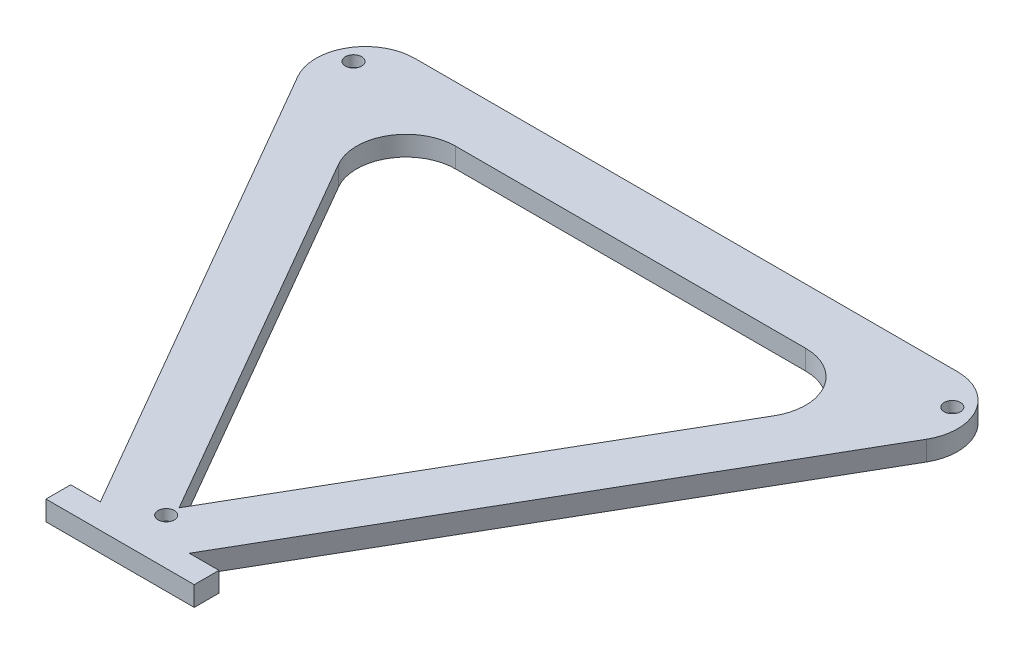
SolidWorks part; units mm, degrees
ref_plane "Front Plane" through (0, 0, 0) normal (0, 0, 1) x (1, 0, 0)
ref_plane "Top Plane" through (0, 0, 0) normal (0, 1, 0) x (1, 0, 0)
ref_plane "Right Plane" through (0, 0, 0) normal (1, 0, 0) x (0, 0, -1)
sketch "Sketch1" plane through (0, 0, 0) normal (0, 1, 0) x (1, 0, 0)
  line L0 (-50.5522, -73.9966) -> (-105.142, 20.5556)
  line L1 (-50.5522, -73.9966) -> (-56.5522, -73.9966)
  line L2 (-56.5522, -78.9966) -> (-56.5522, -73.9966)
  line L3 (-36.5522, -78.9966) -> (-46.5522, -78.9966)
  line L4 (-46.5522, -78.9966) -> (-56.5522, -78.9966)
  line L5 (-26.5522, -78.9966) -> (-36.5522, -78.9966)
  line L6 (-26.5522, -78.9966) -> (-26.5522, -73.9966)
  line L7 (-26.5522, -73.9966) -> (-32.5522, -73.9966)
  line L8 (22.0375, 20.5556) -> (-32.5522, -73.9966)
  line L9 (-96.4817, 35.5556) -> (13.3773, 35.5556)
  line L19 (2.5375, 9.2973) -> (-41.5522, -67.0684)
  line L20 (-76.9817, 24.2973) -> (-6.1227, 24.2973)
  line L21 (-41.5522, -67.0684) -> (-85.642, 9.2973)
  circle A0 centre (-41.5522, -69.6665) radius 1.5
  circle A1 centre (19.0375, 28.8236) radius 1.5775
  circle A2 centre (-102.142, 28.8236) radius 1.5
  arc A3 (-96.4817, 35.5556) -> (-105.142, 30.5556) centre (-96.4817, 25.5556) ccw
  arc A4 (-105.142, 30.5556) -> (-105.142, 20.5556) centre (-96.4817, 25.5556) ccw
  arc A5 (22.0375, 20.5556) -> (22.0375, 30.5556) centre (13.3773, 25.5556) ccw
  arc A6 (22.0375, 30.5556) -> (13.3773, 35.5556) centre (13.3773, 25.5556) ccw
  arc A11 (2.5375, 9.2973) -> (2.5375, 19.2973) centre (-6.1227, 14.2973) ccw
  arc A12 (2.5375, 19.2973) -> (-6.1227, 24.2973) centre (-6.1227, 14.2973) ccw
  arc A13 (-76.9817, 24.2973) -> (-85.642, 19.2973) centre (-76.9817, 14.2973) ccw
  arc A14 (-85.642, 19.2973) -> (-85.642, 9.2973) centre (-76.9817, 14.2973) ccw
  dimension "D1" = 3
  dimension "D2" = 3.155
  dimension "D3" = 10
  dimension "D4" = 13.3773
  dimension "D5" = 19.0375
  dimension "D6" = 22.0375
  dimension "D7" = 26.5522
  dimension "D8" = 32.5522
  dimension "D9" = 36.5522
  dimension "D10" = 41.5522
  dimension "D11" = 20.5556
  dimension "D13" = 28.8236
  dimension "D15" = 102.142
  dimension "D17" = 69.6665
  dimension "D19" = 78.9966
extrude "Boss-Extrude1" add sketch "Sketch1" along normal blind 4 contours L8 L7 L6 L5 L3 L4 L2 L1 L0 A4 A3 L9 A6 A5 | L19 L21 A14 A13 L20 A12 A11
sketch "Sketch2" plane through (0, 4, 0) normal (0, 1, 0) x (1, 0, 0)
  circle A3 centre (-41.5522, -69.6665) radius 1.65
  circle A4 centre (-102.142, 28.8236) radius 1.65
  circle A5 centre (19.0375, 28.8236) radius 1.65
  dimension "D1" = 3.3
extrude "Cut-Extrude1" cut sketch "Sketch2" against normal blind 2.2
